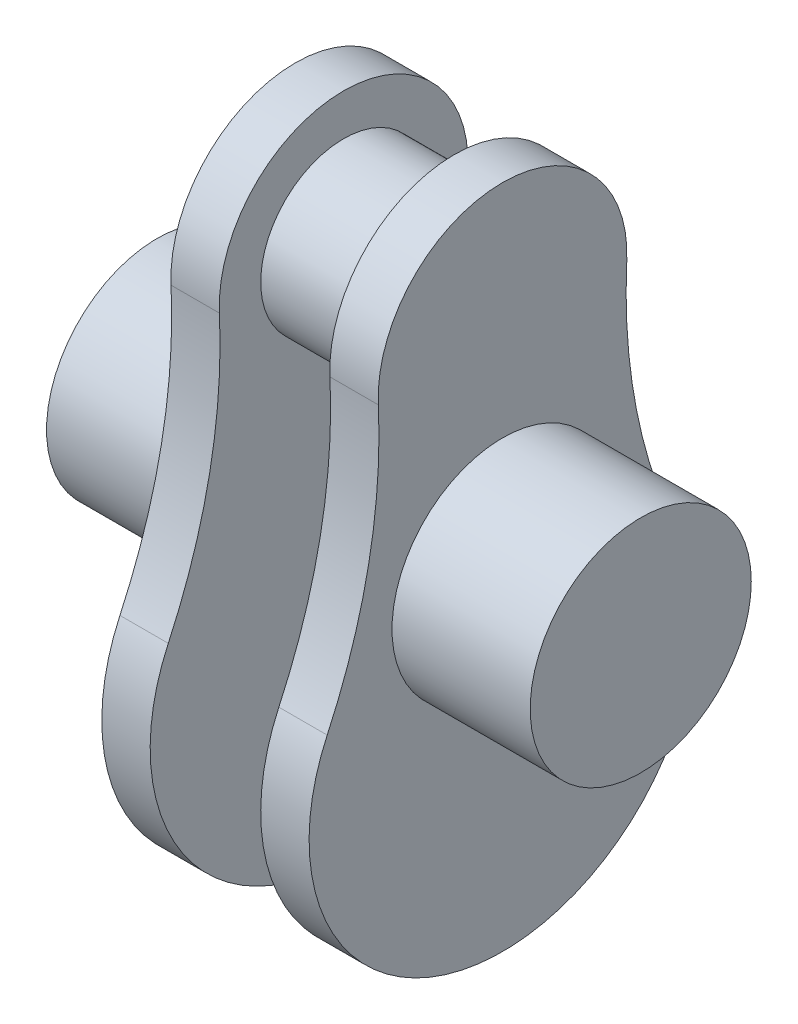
SolidWorks part; units mm, degrees
ref_plane "Płaszczyzna przednia" through (0, 0, 0) normal (0, 0, 1) x (1, 0, 0)
ref_plane "Płaszczyzna górna" through (0, 0, 0) normal (0, 1, 0) x (1, 0, 0)
ref_plane "Płaszczyzna prawa" through (0, 0, 0) normal (1, 0, 0) x (0, 0, -1)
sketch "Szkic1-definicja długości" plane through (0, 0, 0) normal (0, 0, 1) x (1, 0, 0)
  line L0 (-87.5, 0) -> (87.5, 0)
  point P4 (0, 0)
  dimension "D1" = 175
ref_plane "Płaszczyzna1" through (-87.5, 0, 0) normal (1, 0, 0) x (0, 0, -1)
sketch "Szkic2" plane through (-87.5, 0, 0) normal (1, 0, 0) x (0, 0, -1)
  circle A0 centre (0, 0) radius 40
  dimension "D1" = 80
extrude "Czop wału" add sketch "Szkic2" along normal blind 50
sketch "Szkic3" plane through (0, 0, 0) normal (1, 0, 0) x (0, 0, -1)
  circle A0 centre (0, 75) radius 30
  point P2 (0, 0)
  dimension "D1" = 60
  dimension "D2" = 75
extrude "Wykorbienie" add sketch "Szkic3" along normal mid plane 40 separate body
sketch "Szkic4" plane through (-37.5, 0, 0) normal (1, 0, 0) x (0, 0, -1)
  arc A0 (44.9468, 72.8127) -> (-44.9468, 72.8127) centre (0, 75) ccw
  arc A1 (-63.4434, -21.4208) -> (63.4434, -21.4208) centre (0, -51) ccw
  arc A2 (63.4434, -21.4208) -> (44.9468, 72.8127) centre (244.7104, 63.0913) cw
  arc A3 (-63.4434, -21.4208) -> (-44.9468, 72.8127) centre (-244.7104, 63.0913) ccw
  point P10 (0, -60.3328)
  point P11 (0, 0)
  dimension "D1" = 200
  dimension "D2" = 45
  dimension "D3" = 70
  dimension "D4" = 51
extrude "Przeciwwaga" add sketch "Szkic4" along normal up to surface (17.5 mm away)
mirror "Lustro2" about plane through (0, 0, 0) normal (1, 0, 0) of "Czop wału", "Przeciwwaga"
